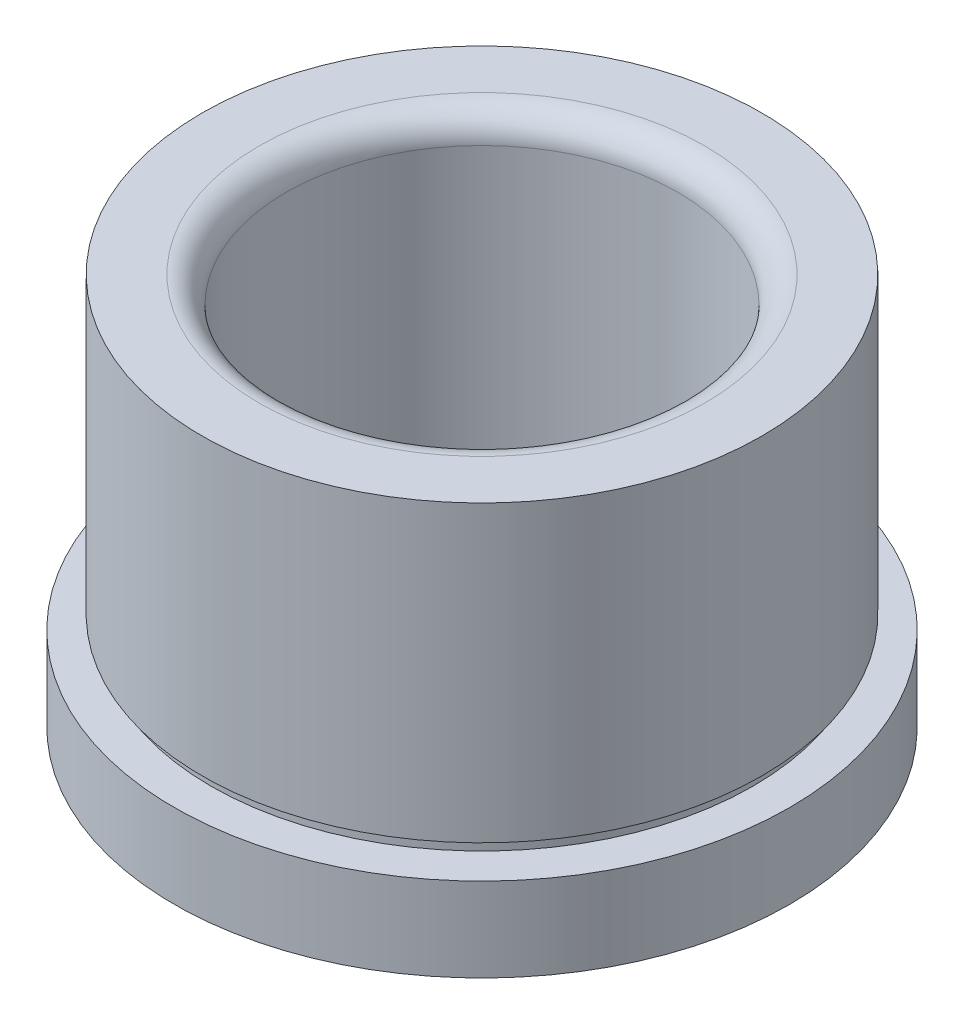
SolidWorks part; units mm, degrees
ref_plane "Front Plane" through (0, 0, 0) normal (0, 0, 1) x (1, 0, 0)
ref_plane "Top Plane" through (0, 0, 0) normal (0, 1, 0) x (1, 0, 0)
ref_plane "Right Plane" through (0, 0, 0) normal (1, 0, 0) x (0, 0, -1)
sketch "Sketch1" plane through (0, 0, 0) normal (0, 0, 1) x (1, 0, 0)
  line L0 (-736.3938, 671.5865) -> (36207.1852, -33020.7267) construction
  line L1 (0, -1000) -> (0, 49000) construction
  line L2 (-11.1188, 38.1507) -> (-11.1188, 16.7417)
  line L3 (-11.9349, 15.9257) -> (-17.4625, 15.9257)
  line L4 (-17.4625, 15.9257) -> (-17.4625, 20.6882)
  line L5 (-17.4625, 20.6882) -> (-15.3733, 20.6882)
  line L6 (-15.8813, 38.1507) -> (-15.8813, 21.4502)
  line L7 (-15.8813, 38.1507) -> (-11.1188, 38.1507)
  line L8 (-11.9349, 15.9257) -> (-11.1188, 16.7417)
  line L10 (-15.8813, 21.4502) -> (-15.3733, 21.4502)
  line L11 (-15.3733, 21.4502) -> (-15.3733, 20.6882)
  dimension "D1" = 0.508
  dimension "OD" = 31.7627
  dimension "ID" = 22.2377
  dimension "FLANGETHICKNESS" = 4.7625
  dimension "FLANGEDIA" = 34.925
  dimension "D2" = 45
  dimension "D3" = 0.762
  dimension "OVERALL LENGTH" = 22.225
revolve "Revolve1" add sketch "Sketch1" angle 360 about L1
fillet "Fillet1" radius 1.524 1 edges at (11.1188, 38.1507, 0)
